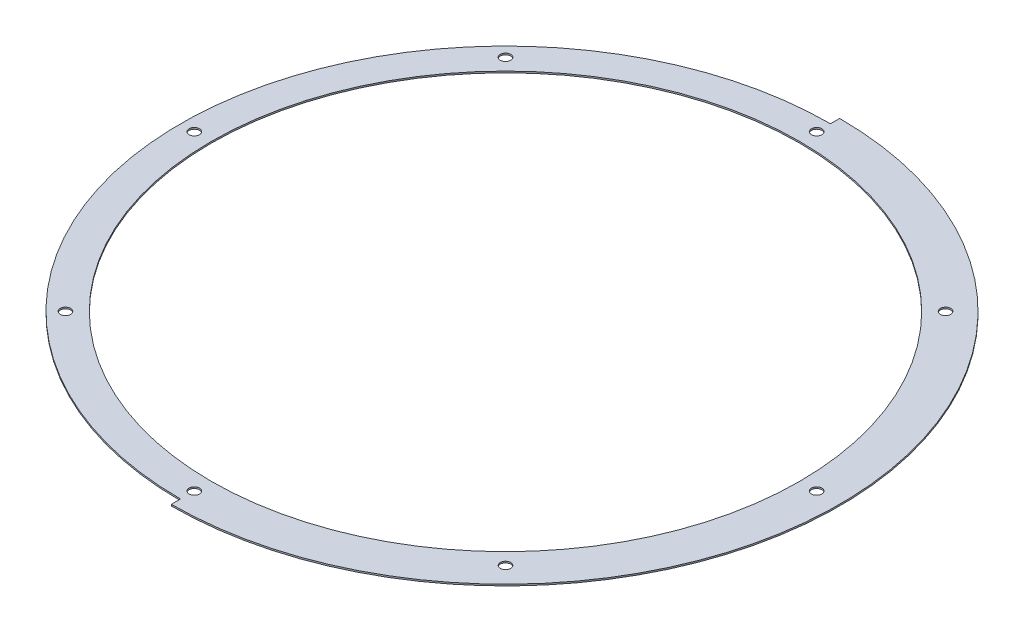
SolidWorks part; units mm, degrees
ref_plane "Front" through (0, 0, 0) normal (0, 0, 1) x (1, 0, 0)
ref_plane "Top" through (0, 0, 0) normal (0, 1, 0) x (1, 0, 0)
ref_plane "Right" through (0, 0, 0) normal (1, 0, 0) x (0, 0, -1)
sketch "Sketch1" plane through (0, 0, 0) normal (0, 1, 0) x (1, 0, 0)
  line L0 (0, 134.62) -> (0, 138.43)
  line L1 (0, -134.62) -> (0, -138.43)
  arc A0 (0, 134.62) -> (0, -134.62) centre (0, 0) ccw
  circle A1 centre (0, 0) radius 121.92
  arc A2 (0, -138.43) -> (0, 138.43) centre (0, 0) ccw
  dimension "D1" = 134.62
  dimension "D2" = 243.84
  dimension "D3" = 3.81
extrude "Boss-Extrude1" add sketch "Sketch1" along normal blind 0.635
hole_wizard "M4 Clearance & 5mm Dowel Pin Hole" positions "Sketch2" profile "Sketch3" hole size "M4" standard "ANSI Metric"
sketch "Sketch2" plane through (0, 0.635, 0) normal (0, 1, 0) x (1, 0, 0)
  point P0 (0, -128.905)
  dimension "D1" = 128.905
sketch "Sketch3" plane through (0, 0.635, 128.905) normal (1, 0, 0) x (0, 0, 1)
  line L0 (0, 0) -> (0, 0.635)
  line L1 (0, 0.635) -> (2.15, 0.635)
  line L2 (2.15, 0.635) -> (2.15, 0)
  line L5 (2.15, 0) -> (0, 0)
  line L11 (0, -6.35) -> (0, 107.95) construction
  dimension "Thru Hole Dia." = 4.3
  dimension "Thru Hole Depth" = 0.635
pattern_circular "CirPattern1" count 8 over 360 about axis through (0, 0, 0) along (0, 1, 0) of "M4 Clearance & 5mm Dowel Pin Hole"
fillet "Round Edges" radius 0.127 4 edges at (0, 0.3175, -138.43) (0, 0.3175, -134.62) (0, 0.3175, 138.43) (0, 0.3175, 134.62)
